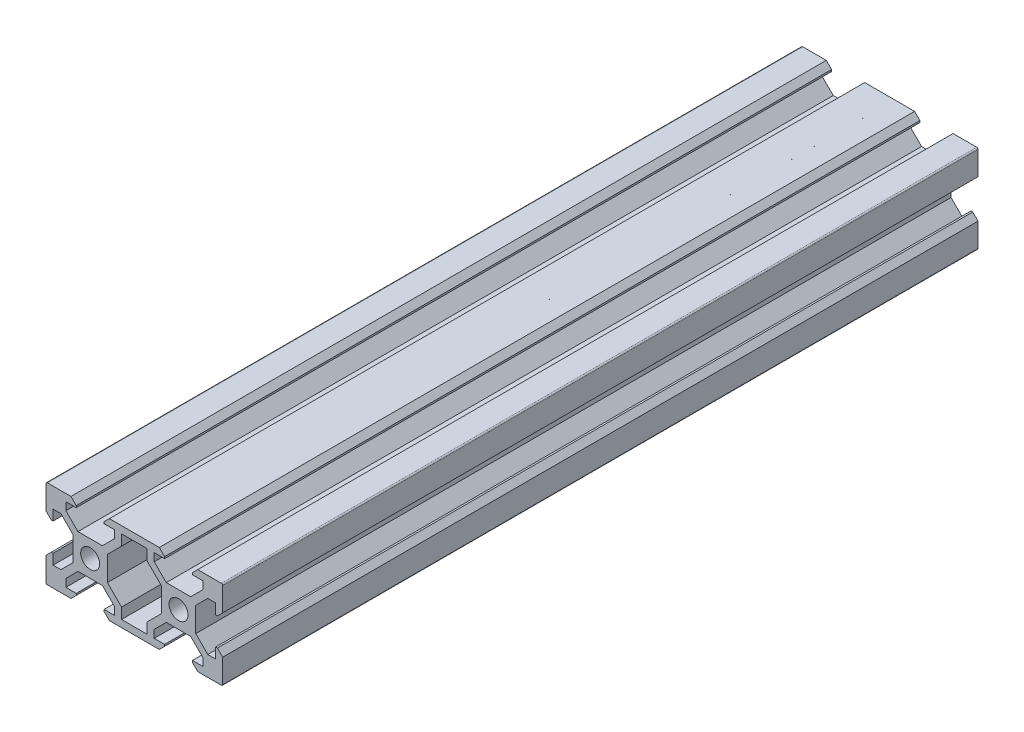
SolidWorks part; units mm, degrees
ref_plane "Front Plane" through (0, 0, 0) normal (0, 0, 1) x (1, 0, 0)
ref_plane "Top Plane" through (0, 0, 0) normal (0, 1, 0) x (1, 0, 0)
ref_plane "Right Plane" through (0, 0, 0) normal (1, 0, 0) x (0, 0, -1)
sketch "Sketch1" plane through (0, 0, 0) normal (0, 0, 1) x (1, 0, 0)
  line B0 (142.2596, 181.5211) -> (142.2596, 187.0584)
  line B1 (142.2596, 187.0584) -> (139.0608, 190.2572)
  line B2 (139.0608, 190.2572) -> (139.0608, 192.6898)
  line B3 (139.0608, 192.6898) -> (133.2608, 192.6898)
  line B4 (133.2608, 192.6898) -> (133.2608, 190.2603)
  line B5 (133.2608, 190.2603) -> (130.0608, 187.0597)
  line B6 (130.0608, 187.0597) -> (130.0608, 181.5223)
  line B7 (130.0608, 181.5223) -> (133.2608, 178.3223)
  line B8 (133.2608, 178.3223) -> (133.2608, 175.8898)
  line B9 (133.2608, 175.8898) -> (139.0608, 175.8898)
  line B10 (139.0608, 175.8898) -> (139.0608, 178.3223)
  line B11 (139.0608, 178.3223) -> (142.2596, 181.5211)
  line B12 (131.6608, 175.8898) -> (129.3108, 175.8898)
  line B13 (116.462, 174.2898) -> (121.8108, 174.2898)
  line B14 (116.162, 179.9398) -> (116.162, 174.5898)
  line B15 (117.362, 181.1398) -> (116.162, 179.9398)
  line B16 (117.762, 181.1398) -> (117.362, 181.1398)
  line B17 (117.762, 178.7898) -> (117.762, 181.1398)
  line B18 (119.5283, 178.7898) -> (117.762, 178.7898)
  line B19 (122.2608, 181.5223) -> (119.5283, 178.7898)
  line B20 (122.2608, 187.0604) -> (122.2608, 181.5223)
  line B21 (119.5312, 189.7898) -> (122.2608, 187.0604)
  line B22 (117.762, 189.7898) -> (119.5312, 189.7898)
  line B23 (117.762, 187.4398) -> (117.762, 189.7898)
  line B24 (117.362, 187.4398) -> (117.762, 187.4398)
  line B25 (116.162, 188.6398) -> (117.362, 187.4398)
  line B26 (116.162, 193.9898) -> (116.162, 188.6398)
  line B27 (121.8108, 194.2898) -> (116.462, 194.2898)
  line B28 (123.0108, 193.0898) -> (121.8108, 194.2898)
  line B29 (123.0108, 192.6898) -> (123.0108, 193.0898)
  line B30 (120.6608, 192.6898) -> (123.0108, 192.6898)
  line B31 (120.6608, 190.9223) -> (120.6608, 192.6898)
  line B32 (123.3932, 188.19) -> (120.6608, 190.9223)
  line B33 (128.9285, 188.19) -> (123.3932, 188.19)
  line B34 (131.6608, 190.9223) -> (128.9285, 188.19)
  line B35 (131.6608, 192.6898) -> (131.6608, 190.9223)
  line B36 (129.3108, 192.6898) -> (131.6608, 192.6898)
  line B37 (129.3108, 193.0898) -> (129.3108, 192.6898)
  line B38 (130.5108, 194.2898) -> (129.3108, 193.0898)
  line B39 (141.8108, 194.2898) -> (130.5108, 194.2898)
  line B40 (143.0108, 193.0898) -> (141.8108, 194.2898)
  line B41 (143.0108, 192.6898) -> (143.0108, 193.0898)
  line B42 (140.6608, 192.6898) -> (143.0108, 192.6898)
  line B43 (140.6608, 190.9193) -> (140.6608, 192.6898)
  line B44 (143.391, 188.1898) -> (140.6608, 190.9193)
  line B45 (148.9241, 188.1898) -> (143.391, 188.1898)
  line B46 (151.6608, 190.9282) -> (148.9241, 188.1898)
  line B47 (151.6608, 192.6898) -> (151.6608, 190.9282)
  line B48 (149.3108, 192.6898) -> (151.6608, 192.6898)
  line B49 (149.3108, 193.0898) -> (149.3108, 192.6898)
  line B50 (150.5108, 194.2898) -> (149.3108, 193.0898)
  line B51 (155.8608, 194.2898) -> (150.5108, 194.2898)
  line B52 (156.1608, 188.6398) -> (156.1608, 193.9898)
  line B53 (154.9608, 187.4398) -> (156.1608, 188.6398)
  line B54 (154.5608, 187.4398) -> (154.9608, 187.4398)
  line B55 (154.5608, 189.7898) -> (154.5608, 187.4398)
  line B56 (152.7934, 189.7898) -> (154.5608, 189.7898)
  line B57 (150.0596, 187.056) -> (152.7934, 189.7898)
  line B58 (150.0596, 181.5227) -> (150.0596, 187.056)
  line B59 (152.7932, 178.7898) -> (150.0596, 181.5227)
  line B60 (154.5608, 178.7898) -> (152.7932, 178.7898)
  line B61 (154.5608, 181.1398) -> (154.5608, 178.7898)
  line B62 (154.9608, 181.1398) -> (154.5608, 181.1398)
  line B63 (156.1608, 179.9398) -> (154.9608, 181.1398)
  line B64 (156.1608, 174.5898) -> (156.1608, 179.9398)
  line B65 (150.5108, 174.2898) -> (155.8608, 174.2898)
  line B66 (149.3108, 175.4898) -> (150.5108, 174.2898)
  line B67 (149.3108, 175.8898) -> (149.3108, 175.4898)
  line B68 (151.6608, 175.8898) -> (149.3108, 175.8898)
  line B69 (151.6608, 177.6572) -> (151.6608, 175.8898)
  line B70 (148.9283, 180.3898) -> (151.6608, 177.6572)
  line B71 (143.3934, 180.3898) -> (148.9283, 180.3898)
  line B72 (140.6608, 177.6572) -> (143.3934, 180.3898)
  line B73 (140.6608, 175.8898) -> (140.6608, 177.6572)
  line B74 (143.0108, 175.8898) -> (140.6608, 175.8898)
  line B75 (143.0108, 175.4898) -> (143.0108, 175.8898)
  line B76 (141.8108, 174.2898) -> (143.0108, 175.4898)
  line B77 (130.5108, 174.2898) -> (141.8108, 174.2898)
  line B78 (129.3108, 175.4898) -> (130.5108, 174.2898)
  line B79 (129.3108, 175.8898) -> (129.3108, 175.4898)
  line B80 (131.6608, 177.6614) -> (131.6608, 175.8898)
  line B81 (128.932, 180.39) -> (131.6608, 177.6614)
  line B82 (123.3924, 180.39) -> (128.932, 180.39)
  line B83 (120.6608, 177.6579) -> (123.3924, 180.39)
  line B84 (120.6608, 175.8898) -> (120.6608, 177.6579)
  line B85 (123.0108, 175.8898) -> (120.6608, 175.8898)
  line B86 (123.0108, 175.4898) -> (123.0108, 175.8898)
  line B87 (121.8108, 174.2898) -> (123.0108, 175.4898)
  circle B88 centre (146.1608, 184.2898) radius 2.15
  arc B89 (116.162, 174.5898) -> (116.462, 174.2898) centre (116.462, 174.5898) ccw
  arc B90 (116.462, 194.2898) -> (116.162, 193.9898) centre (116.462, 193.9898) ccw
  arc B91 (156.1608, 193.9898) -> (155.8608, 194.2898) centre (155.8608, 193.9898) ccw
  arc B92 (155.8608, 174.2898) -> (156.1608, 174.5898) centre (155.8608, 174.5898) ccw
  circle B93 centre (126.1641, 184.29) radius 2.15
sketch_block_instance "Block1-1"
sketch_block "Block1"
extrude "Boss-Extrude1" add sketch "Sketch1" along normal blind 41
sketch "Sketch2" plane through (0, 0, 0) normal (0, 0, -1) x (-1, 0, 0)
  line L0 (-133.2608, 192.6898) -> (-133.2608, 190.2603) construction
  line L1 (-133.2608, 192.6898) -> (-133.2608, 190.2603)
  line L2 (-139.0608, 192.6898) -> (-133.2608, 192.6898) construction
  line L3 (-139.0608, 190.2572) -> (-139.0608, 192.6898) construction
  line L4 (-142.2596, 187.0584) -> (-139.0608, 190.2572) construction
  line L5 (-142.2596, 181.5211) -> (-142.2596, 187.0584) construction
  line L6 (-139.0608, 178.3223) -> (-142.2596, 181.5211) construction
  line L7 (-139.0608, 175.8898) -> (-139.0608, 178.3223) construction
  line L8 (-133.2608, 175.8898) -> (-139.0608, 175.8898) construction
  line L9 (-133.2608, 178.3223) -> (-133.2608, 175.8898) construction
  line L10 (-130.0608, 181.5223) -> (-133.2608, 178.3223) construction
  line L11 (-130.0608, 187.0597) -> (-130.0608, 181.5223) construction
  line L12 (-133.2608, 190.2603) -> (-130.0608, 187.0597) construction
  line L13 (-139.0608, 192.6898) -> (-133.2608, 192.6898)
  line L14 (-139.0608, 190.2572) -> (-139.0608, 192.6898)
  line L15 (-142.2596, 187.0584) -> (-139.0608, 190.2572)
  line L16 (-142.2596, 181.5211) -> (-142.2596, 187.0584)
  line L17 (-139.0608, 178.3223) -> (-142.2596, 181.5211)
  line L18 (-139.0608, 175.8898) -> (-139.0608, 178.3223)
  line L19 (-133.2608, 175.8898) -> (-139.0608, 175.8898)
  line L20 (-133.2608, 178.3223) -> (-133.2608, 175.8898)
  line L21 (-130.0608, 181.5223) -> (-133.2608, 178.3223)
  line L22 (-130.0608, 187.0597) -> (-130.0608, 181.5223)
  line L23 (-133.2608, 190.2603) -> (-130.0608, 187.0597)
  line L76 (-129.3108, 175.4898) -> (-129.3108, 175.8898)
  line L77 (-129.3108, 175.8898) -> (-131.6608, 175.8898)
  line L78 (-131.6608, 175.8898) -> (-131.6608, 177.6614)
  line L79 (-131.6608, 177.6614) -> (-128.932, 180.39)
  line L80 (-128.932, 180.39) -> (-123.3924, 180.39)
  line L81 (-123.3924, 180.39) -> (-120.6608, 177.6579)
  line L82 (-120.6608, 177.6579) -> (-120.6608, 175.8898)
  line L83 (-120.6608, 175.8898) -> (-123.0108, 175.8898)
  line L84 (-123.0108, 175.8898) -> (-123.0108, 175.4898)
  line L85 (-123.0108, 175.4898) -> (-121.8108, 174.2898)
  line L86 (-121.8108, 174.2898) -> (-116.462, 174.2898)
  line L87 (-116.162, 174.5898) -> (-116.162, 179.9398)
  line L88 (-116.162, 179.9398) -> (-117.362, 181.1398)
  line L89 (-117.362, 181.1398) -> (-117.762, 181.1398)
  line L90 (-117.762, 181.1398) -> (-117.762, 178.7898)
  line L91 (-117.762, 178.7898) -> (-119.5283, 178.7898)
  line L92 (-119.5283, 178.7898) -> (-122.2608, 181.5223)
  line L93 (-122.2608, 181.5223) -> (-122.2608, 187.0604)
  line L94 (-122.2608, 187.0604) -> (-119.5312, 189.7898)
  line L95 (-119.5312, 189.7898) -> (-117.762, 189.7898)
  line L96 (-117.762, 189.7898) -> (-117.762, 187.4398)
  line L97 (-117.762, 187.4398) -> (-117.362, 187.4398)
  line L98 (-117.362, 187.4398) -> (-116.162, 188.6398)
  line L99 (-116.162, 188.6398) -> (-116.162, 193.9898)
  line L100 (-116.462, 194.2898) -> (-121.8108, 194.2898)
  line L101 (-121.8108, 194.2898) -> (-123.0108, 193.0898)
  line L102 (-123.0108, 193.0898) -> (-123.0108, 192.6898)
  line L103 (-123.0108, 192.6898) -> (-120.6608, 192.6898)
  line L104 (-120.6608, 192.6898) -> (-120.6608, 190.9223)
  line L105 (-120.6608, 190.9223) -> (-123.3932, 188.19)
  line L106 (-123.3932, 188.19) -> (-128.9285, 188.19)
  line L107 (-128.9285, 188.19) -> (-131.6608, 190.9223)
  line L108 (-131.6608, 190.9223) -> (-131.6608, 192.6898)
  line L109 (-131.6608, 192.6898) -> (-129.3108, 192.6898)
  line L110 (-129.3108, 192.6898) -> (-129.3108, 193.0898)
  line L111 (-129.3108, 193.0898) -> (-130.5108, 194.2898)
  line L112 (-130.5108, 194.2898) -> (-141.8108, 194.2898)
  line L113 (-141.8108, 194.2898) -> (-143.0108, 193.0898)
  line L114 (-143.0108, 193.0898) -> (-143.0108, 192.6898)
  line L115 (-143.0108, 192.6898) -> (-140.6608, 192.6898)
  line L116 (-140.6608, 192.6898) -> (-140.6608, 190.9193)
  line L117 (-140.6608, 190.9193) -> (-143.391, 188.1898)
  line L118 (-143.391, 188.1898) -> (-148.9241, 188.1898)
  line L119 (-148.9241, 188.1898) -> (-151.6608, 190.9282)
  line L120 (-151.6608, 190.9282) -> (-151.6608, 192.6898)
  line L121 (-151.6608, 192.6898) -> (-149.3108, 192.6898)
  line L122 (-149.3108, 192.6898) -> (-149.3108, 193.0898)
  line L123 (-149.3108, 193.0898) -> (-150.5108, 194.2898)
  line L124 (-150.5108, 194.2898) -> (-155.8608, 194.2898)
  line L125 (-156.1608, 193.9898) -> (-156.1608, 188.6398)
  line L126 (-156.1608, 188.6398) -> (-154.9608, 187.4398)
  line L127 (-154.9608, 187.4398) -> (-154.5608, 187.4398)
  line L128 (-154.5608, 187.4398) -> (-154.5608, 189.7898)
  line L129 (-154.5608, 189.7898) -> (-152.7934, 189.7898)
  line L130 (-152.7934, 189.7898) -> (-150.0596, 187.056)
  line L131 (-150.0596, 187.056) -> (-150.0596, 181.5227)
  line L132 (-150.0596, 181.5227) -> (-152.7932, 178.7898)
  line L133 (-152.7932, 178.7898) -> (-154.5608, 178.7898)
  line L134 (-154.5608, 178.7898) -> (-154.5608, 181.1398)
  line L135 (-154.5608, 181.1398) -> (-154.9608, 181.1398)
  line L136 (-154.9608, 181.1398) -> (-156.1608, 179.9398)
  line L137 (-156.1608, 179.9398) -> (-156.1608, 174.5898)
  line L138 (-155.8608, 174.2898) -> (-150.5108, 174.2898)
  line L139 (-150.5108, 174.2898) -> (-149.3108, 175.4898)
  line L140 (-149.3108, 175.4898) -> (-149.3108, 175.8898)
  line L141 (-149.3108, 175.8898) -> (-151.6608, 175.8898)
  line L142 (-151.6608, 175.8898) -> (-151.6608, 177.6572)
  line L143 (-151.6608, 177.6572) -> (-148.9283, 180.3898)
  line L144 (-148.9283, 180.3898) -> (-143.3934, 180.3898)
  line L145 (-143.3934, 180.3898) -> (-140.6608, 177.6572)
  line L146 (-140.6608, 177.6572) -> (-140.6608, 175.8898)
  line L147 (-140.6608, 175.8898) -> (-143.0108, 175.8898)
  line L148 (-143.0108, 175.8898) -> (-143.0108, 175.4898)
  line L149 (-143.0108, 175.4898) -> (-141.8108, 174.2898)
  line L150 (-141.8108, 174.2898) -> (-130.5108, 174.2898)
  line L151 (-130.5108, 174.2898) -> (-129.3108, 175.4898)
  line L152 (-129.3108, 175.4898) -> (-129.3108, 175.8898)
  line L153 (-129.3108, 175.8898) -> (-131.6608, 175.8898)
  line L154 (-131.6608, 175.8898) -> (-131.6608, 177.6614)
  line L155 (-131.6608, 177.6614) -> (-128.932, 180.39)
  line L156 (-128.932, 180.39) -> (-123.3924, 180.39)
  line L157 (-123.3924, 180.39) -> (-120.6608, 177.6579)
  line L158 (-120.6608, 177.6579) -> (-120.6608, 175.8898)
  line L159 (-120.6608, 175.8898) -> (-123.0108, 175.8898)
  line L160 (-123.0108, 175.8898) -> (-123.0108, 175.4898)
  line L161 (-123.0108, 175.4898) -> (-121.8108, 174.2898)
  line L162 (-121.8108, 174.2898) -> (-116.462, 174.2898)
  line L163 (-116.162, 174.5898) -> (-116.162, 179.9398)
  line L164 (-116.162, 179.9398) -> (-117.362, 181.1398)
  line L165 (-117.362, 181.1398) -> (-117.762, 181.1398)
  line L166 (-117.762, 181.1398) -> (-117.762, 178.7898)
  line L167 (-117.762, 178.7898) -> (-119.5283, 178.7898)
  line L168 (-119.5283, 178.7898) -> (-122.2608, 181.5223)
  line L169 (-122.2608, 181.5223) -> (-122.2608, 187.0604)
  line L170 (-122.2608, 187.0604) -> (-119.5312, 189.7898)
  line L171 (-119.5312, 189.7898) -> (-117.762, 189.7898)
  line L172 (-117.762, 189.7898) -> (-117.762, 187.4398)
  line L173 (-117.762, 187.4398) -> (-117.362, 187.4398)
  line L174 (-117.362, 187.4398) -> (-116.162, 188.6398)
  line L175 (-116.162, 188.6398) -> (-116.162, 193.9898)
  line L176 (-116.462, 194.2898) -> (-121.8108, 194.2898)
  line L177 (-121.8108, 194.2898) -> (-123.0108, 193.0898)
  line L178 (-123.0108, 193.0898) -> (-123.0108, 192.6898)
  line L179 (-123.0108, 192.6898) -> (-120.6608, 192.6898)
  line L180 (-120.6608, 192.6898) -> (-120.6608, 190.9223)
  line L181 (-120.6608, 190.9223) -> (-123.3932, 188.19)
  line L182 (-123.3932, 188.19) -> (-128.9285, 188.19)
  line L183 (-128.9285, 188.19) -> (-131.6608, 190.9223)
  line L184 (-131.6608, 190.9223) -> (-131.6608, 192.6898)
  line L185 (-131.6608, 192.6898) -> (-129.3108, 192.6898)
  line L186 (-129.3108, 192.6898) -> (-129.3108, 193.0898)
  line L187 (-129.3108, 193.0898) -> (-130.5108, 194.2898)
  line L188 (-130.5108, 194.2898) -> (-141.8108, 194.2898)
  line L189 (-141.8108, 194.2898) -> (-143.0108, 193.0898)
  line L190 (-143.0108, 193.0898) -> (-143.0108, 192.6898)
  line L191 (-143.0108, 192.6898) -> (-140.6608, 192.6898)
  line L192 (-140.6608, 192.6898) -> (-140.6608, 190.9193)
  line L193 (-140.6608, 190.9193) -> (-143.391, 188.1898)
  line L194 (-143.391, 188.1898) -> (-148.9241, 188.1898)
  line L195 (-148.9241, 188.1898) -> (-151.6608, 190.9282)
  line L196 (-151.6608, 190.9282) -> (-151.6608, 192.6898)
  line L197 (-151.6608, 192.6898) -> (-149.3108, 192.6898)
  line L198 (-149.3108, 192.6898) -> (-149.3108, 193.0898)
  line L199 (-149.3108, 193.0898) -> (-150.5108, 194.2898)
  line L200 (-150.5108, 194.2898) -> (-155.8608, 194.2898)
  line L201 (-156.1608, 193.9898) -> (-156.1608, 188.6398)
  line L202 (-156.1608, 188.6398) -> (-154.9608, 187.4398)
  line L203 (-154.9608, 187.4398) -> (-154.5608, 187.4398)
  line L204 (-154.5608, 187.4398) -> (-154.5608, 189.7898)
  line L205 (-154.5608, 189.7898) -> (-152.7934, 189.7898)
  line L206 (-152.7934, 189.7898) -> (-150.0596, 187.056)
  line L207 (-150.0596, 187.056) -> (-150.0596, 181.5227)
  line L208 (-150.0596, 181.5227) -> (-152.7932, 178.7898)
  line L209 (-152.7932, 178.7898) -> (-154.5608, 178.7898)
  line L210 (-154.5608, 178.7898) -> (-154.5608, 181.1398)
  line L211 (-154.5608, 181.1398) -> (-154.9608, 181.1398)
  line L212 (-154.9608, 181.1398) -> (-156.1608, 179.9398)
  line L213 (-156.1608, 179.9398) -> (-156.1608, 174.5898)
  line L214 (-155.8608, 174.2898) -> (-150.5108, 174.2898)
  line L215 (-150.5108, 174.2898) -> (-149.3108, 175.4898)
  line L216 (-149.3108, 175.4898) -> (-149.3108, 175.8898)
  line L217 (-149.3108, 175.8898) -> (-151.6608, 175.8898)
  line L218 (-151.6608, 175.8898) -> (-151.6608, 177.6572)
  line L219 (-151.6608, 177.6572) -> (-148.9283, 180.3898)
  line L220 (-148.9283, 180.3898) -> (-143.3934, 180.3898)
  line L221 (-143.3934, 180.3898) -> (-140.6608, 177.6572)
  line L222 (-140.6608, 177.6572) -> (-140.6608, 175.8898)
  line L223 (-140.6608, 175.8898) -> (-143.0108, 175.8898)
  line L224 (-143.0108, 175.8898) -> (-143.0108, 175.4898)
  line L225 (-143.0108, 175.4898) -> (-141.8108, 174.2898)
  line L226 (-141.8108, 174.2898) -> (-130.5108, 174.2898)
  line L227 (-130.5108, 174.2898) -> (-129.3108, 175.4898)
  circle A0 centre (-126.1641, 184.29) radius 2.15 construction
  circle A1 centre (-126.1641, 184.29) radius 2.15
  circle A2 centre (-146.1608, 184.2898) radius 2.15 construction
  circle A3 centre (-146.1608, 184.2898) radius 2.15
  arc A4 (-116.462, 174.2898) -> (-116.162, 174.5898) centre (-116.462, 174.5898) ccw
  arc A5 (-116.162, 193.9898) -> (-116.462, 194.2898) centre (-116.462, 193.9898) ccw
  arc A6 (-155.8608, 194.2898) -> (-156.1608, 193.9898) centre (-155.8608, 193.9898) ccw
  arc A7 (-156.1608, 174.5898) -> (-155.8608, 174.2898) centre (-155.8608, 174.5898) ccw
  arc A8 (-116.462, 174.2898) -> (-116.162, 174.5898) centre (-116.462, 174.5898) ccw
  arc A9 (-116.162, 193.9898) -> (-116.462, 194.2898) centre (-116.462, 193.9898) ccw
  arc A10 (-155.8608, 194.2898) -> (-156.1608, 193.9898) centre (-155.8608, 193.9898) ccw
  arc A11 (-156.1608, 174.5898) -> (-155.8608, 174.2898) centre (-155.8608, 174.5898) ccw
  dimension "D1" = 0
extrude "Boss-Extrude2" add sketch "Sketch2" along normal blind 130 contours L213 A11 L214 L215 L216 L217 L218 L219 L220 L221 L222 L223 L224 L225 L226 L227 L152 L153 L154 L155 L156 L157 L158 L159 L160 L161 L162 A8 L163 L164 L165 L166 L167 L168 L169 L170 L171 L172 L173 L174 L175 A9 L176 L177 L178 L179 L180 L181 L182 L183 L184 | L13 L1 L23 L22 L21 L20 L19 L18 L17 L16 L15 L14 | A3 | A1
